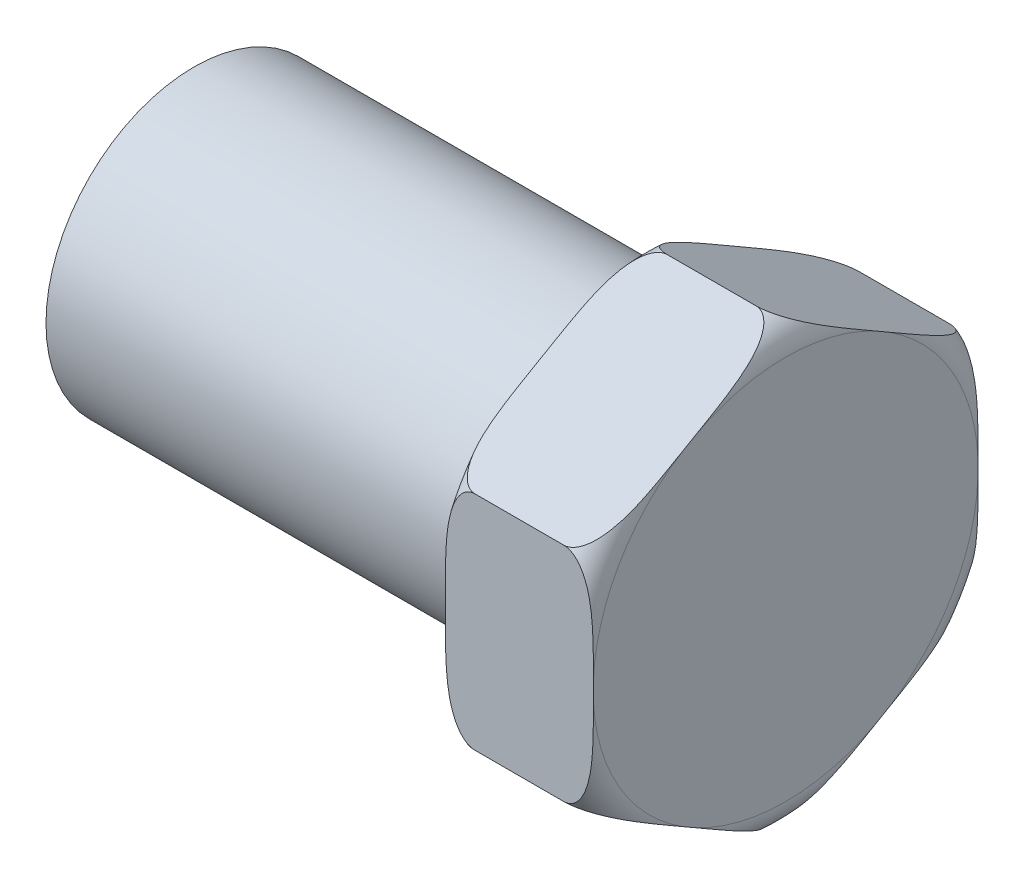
SolidWorks part; units mm, degrees
ref_plane "Front Plane" through (0, 0, 0) normal (0, 0, 1) x (1, 0, 0)
ref_plane "Top Plane" through (0, 0, 0) normal (0, 1, 0) x (1, 0, 0)
ref_plane "Right Plane" through (0, 0, 0) normal (1, 0, 0) x (0, 0, -1)
sketch "Sketch1" plane through (0, 0, 0) normal (0, 0, 1) x (1, 0, 0)
  line L0 (0, 0) -> (10.1698, 0) construction
  line L1 (0, 0) -> (0, 1.5875)
  line L2 (0, 1.5875) -> (4.7625, 1.5875)
  line L3 (4.7625, 1.5875) -> (4.7625, 0)
  line L4 (0, 0) -> (4.7625, 0)
  dimension "PIPE SIZE" = 3.175
  dimension "D2" = 4.7625
revolve "Revolve1" add sketch "Sketch1" angle 360 about L0
sketch "Sketch2" plane through (4.7625, 0, 0) normal (1, 0, 0) x (0, 0, -1)
  line L1 (0, 2.383) -> (-2.0637, 1.1915)
  line L2 (-2.0637, 1.1915) -> (-2.0637, -1.1915)
  line L3 (-2.0637, -1.1915) -> (0, -2.383)
  line L4 (0, -2.383) -> (2.0637, -1.1915)
  line L5 (2.0637, -1.1915) -> (2.0637, 1.1915)
  line L6 (2.0637, 1.1915) -> (0, 2.383)
  circle A0 centre (0, 0) radius 2.0638 construction
  circle A2 centre (0, 0) radius 1.5875 construction
  dimension "D1" = 0.4762
extrude "Extrude1" add sketch "Sketch2" along normal blind 1.5875
sketch "Sketch3" plane through (0, 0, 0) normal (0, 0, 1) x (1, 0, 0)
  line L0 (6.35, 2.383) -> (4.7625, 2.383) construction
  line L1 (4.7625, 2.383) -> (4.7625, 1.1915) construction
  line L2 (6.35, 2.383) -> (6.35, 1.1915) construction
  line L3 (5.08, 2.383) -> (4.7625, 2.383)
  line L4 (4.7625, 2.383) -> (4.7625, 2.0655)
  line L5 (6.0325, 2.383) -> (6.35, 2.383)
  line L6 (6.35, 2.383) -> (6.35, 2.0655)
  line L7 (0, 0) -> (8.0061, 0) construction
  arc A0 (5.08, 2.383) -> (4.7625, 2.0655) centre (5.08, 2.0655) ccw
  arc A1 (6.0325, 2.383) -> (6.35, 2.0655) centre (6.0325, 2.0655) cw
  dimension "D1" = 0.3175
  dimension "D2" = 0.3175
revolve "Cut-Revolve1" cut sketch "Sketch3" angle 360 about L7
equation "\"D2@Sketch1\" = \"PIPE SIZE@Sketch1\"*1.5"
equation "\"D1@Sketch2\" = \"PIPE SIZE@Sketch1\"*0.15"
equation "\"D1@Extrude1\" = \"PIPE SIZE@Sketch1\"/2"
equation "\"D1@Sketch3\" = \"PIPE SIZE@Sketch1\"*0.1"
equation "\"D2@Sketch3\" = \"D1@Sketch3\""
